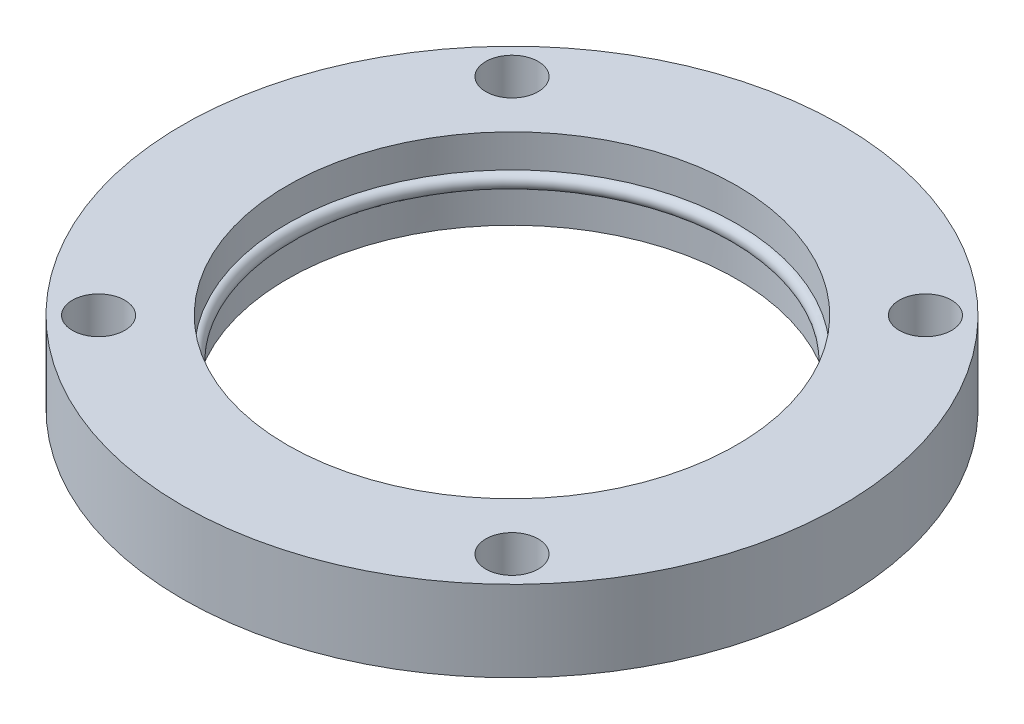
SolidWorks part; units mm, degrees
ref_plane "Front Plane" through (0, 0, 0) normal (0, 0, 1) x (1, 0, 0)
ref_plane "Top Plane" through (0, 0, 0) normal (0, 1, 0) x (1, 0, 0)
ref_plane "Right Plane" through (0, 0, 0) normal (1, 0, 0) x (0, 0, -1)
sketch "Sketch2" plane through (0, 0, 0) normal (0, 1, 0) x (1, 0, 0)
  line L1 (-69, -69) -> (69, -69) construction
  line L2 (-69, -69) -> (-69, 69) construction
  line L3 (-69, 69) -> (69, 69) construction
  line L4 (69, -69) -> (69, 69) construction
  line L5 (-69, -69) -> (69, 69) construction
  line L6 (-69, 69) -> (69, -69) construction
  circle A0 centre (0, 0) radius 75
  circle A1 centre (0, 0) radius 110
  circle A2 centre (-69, 69) radius 8.75
  circle A3 centre (69, 69) radius 8.75
  circle A4 centre (69, -69) radius 8.75
  circle A5 centre (-69, -69) radius 8.75
  dimension "D1" = 220
  dimension "D2" = 150
  dimension "D4" = 17.5
  dimension "D3" = 138
extrude "Boss-Extrude1" add sketch "Sketch2" along normal mid plane 27
sketch "Sketch3" plane through (0, 0, 0) normal (0, 0, 1) x (1, 0, 0)
  line L0 (-75, 0) -> (0, 0) construction
  line L1 (0, 0) -> (0, 13.5) construction
  line L2 (110, 13.5) -> (-110, 13.5) construction
  circle A0 centre (-75, 0) radius 2.5
  dimension "D1" = 5
  dimension "D2" = 150
revolve "Revolve2" add sketch "Sketch3" angle 360 about L1
